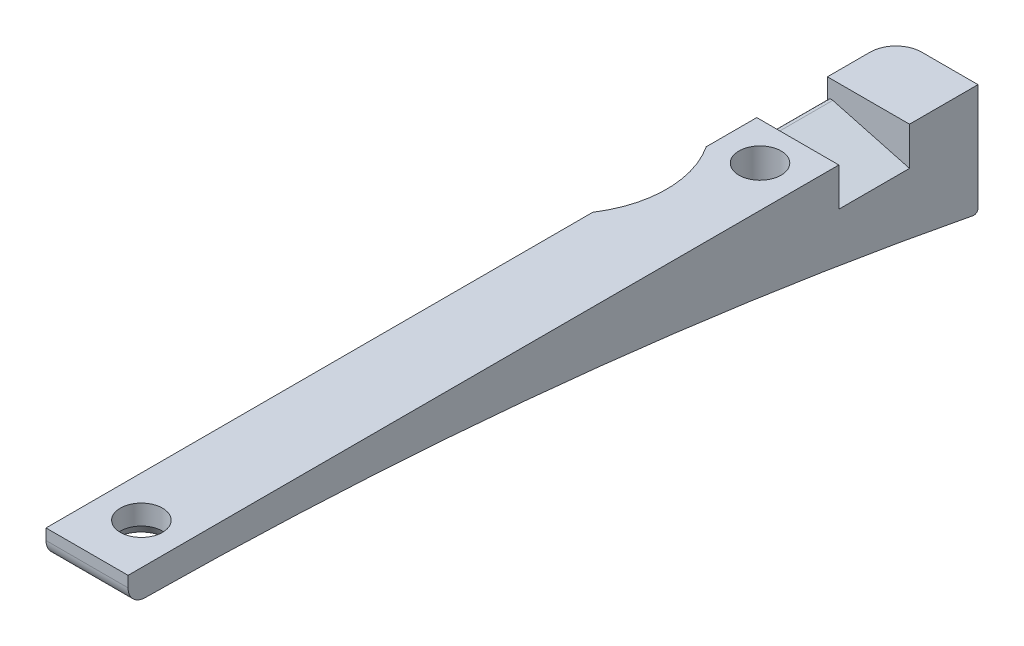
SolidWorks part; units mm, degrees
ref_plane "Спереди" through (0, 0, 0) normal (0, 0, 1) x (1, 0, 0)
ref_plane "Сверху" through (0, 0, 0) normal (0, 1, 0) x (1, 0, 0)
ref_plane "Справа" through (0, 0, 0) normal (1, 0, 0) x (0, 0, -1)
sketch "Эскиз1" plane through (0, 0, 0) normal (1, 0, 0) x (0, 0, -1)
  line L0 (-79.4258, -1.0165) -> (-79.4258, 0)
  line L1 (-79.4258, 0) -> (0, 0)
  line L2 (0, 0) -> (0, -10.0033)
  arc A0 (-0.453, -10.3774) -> (-77.8544, -2.6039) centre (-82.2548, -435.6516) ccw
  arc A1 (-79.4258, -1.0165) -> (-77.8544, -2.6039) centre (-77.8383, -1.0165) ccw
  arc A2 (0, -10.0033) -> (-0.453, -10.3774) centre (-0.381, -10.0033) cw
  point P8 (-79.4258, -2.5908)
  point P11 (0, -10.4648)
  dimension "D4" = 433.07
  dimension "D5" = 1.5875
  dimension "D6" = 0.381
  dimension "D1" = 2.5908
  dimension "D2" = 10.4648
  dimension "D3" = 79.4258
extrude "Бобышка-Вытянуть1" add sketch "Эскиз1" along normal mid plane 7.6708
sketch "Эскиз2" plane through (0, 0, 0) normal (0, 0, -1) x (-1, 0, 0)
  line L0 (-3.8354, -3.5794) -> (3.8354, -1.524)
  line L1 (-3.8354, -10.0033) -> (-3.8354, 0) construction
  line L2 (3.8354, -10.0033) -> (3.8354, 0) construction
  line L3 (3.8354, -1.524) -> (3.8354, 0)
  line L4 (3.8354, 0) -> (-3.8354, 0)
  line L5 (-3.8354, 0) -> (-3.8354, -3.5794)
  dimension "D1" = 1.524
  dimension "D2" = 15
extrude "Вырез-Вытянуть1" cut sketch "Эскиз2" against normal blind 6.604 from offset 6.4008
fillet "Скругление1" radius 0.3969 1 edges at (-3.8354, -1.524, 9.7028)
sketch "Эскиз3" plane through (0, 0, 0) normal (1, 0, 0) x (0, 0, -1)
  line L0 (-16.5354, 3.3928) -> (-16.5354, -7.5971) construction
  line L1 (-14.5669, 0) -> (-16.5354, 0)
  line L2 (-16.5354, 0) -> (-16.5354, -8.0153)
  line L3 (-16.5354, -8.0153) -> (-13.8672, -8.0153)
  line L4 (-13.8672, -8.0153) -> (-14.5669, -6.8034)
  line L5 (-14.5669, -6.8034) -> (-14.5669, 0)
  arc A0 (-0.453, -10.3774) -> (-77.8544, -2.6039) centre (-82.2548, -435.6516) ccw construction
  dimension "D1" = 3.937
  dimension "D2" = 30
  dimension "D3" = 0.7937
  dimension "D4" = 16.5354
revolve "Вырез-Повернуть1" cut sketch "Эскиз3" angle 360 about L0
sketch "Эскиз4" plane through (0, 0, 0) normal (1, 0, 0) x (0, 0, -1)
  line L0 (-74.3458, 7.5093) -> (-74.3458, -2.6538) construction
  line L1 (-74.3458, 0) -> (-72.3773, 0)
  line L2 (-72.3773, 0) -> (-72.3773, -1.86)
  line L3 (-72.3773, -1.86) -> (-71.8891, -2.7056)
  line L4 (-71.8891, -2.7056) -> (-74.3458, -2.7056)
  line L5 (-74.3458, -2.7056) -> (-74.3458, 0)
  line L6 (-13.0048, 0) -> (-79.4258, 0) construction
  arc A0 (-0.453, -10.3774) -> (-77.8544, -2.6039) centre (-82.2548, -435.6516) ccw construction
  dimension "D1" = 74.3458
  dimension "D2" = 3.937
  dimension "D3" = 30
  dimension "D4" = 0.7937
revolve "Вырез-Повернуть2" cut sketch "Эскиз4" angle 360 about L0
sketch "Эскиз5" plane through (0, 0, 0) normal (0, 1, 0) x (1, 0, 0)
  line L0 (-3.8354, -2.413) -> (-3.8354, 0)
  line L2 (-3.8354, 0) -> (-3.8354, -6.4008) construction
  line L4 (-3.8354, 0) -> (-1.4224, 0)
  line L5 (3.8354, 0) -> (-3.8354, 0) construction
  arc A0 (-3.8354, -2.413) -> (-1.4224, 0) centre (-1.4224, -2.413) cw
  dimension "D1" = 2.413
extrude "Вырез-Вытянуть2" cut sketch "Эскиз5" against normal through all
ref_plane "Плоскость1" through (0, 0, 23.0188) normal (0, 0, -1) x (-1, 0, 0)
sketch "Эскиз6" plane through (0, 0, 23.0188) normal (0, 0, -1) x (-1, 0, 0)
  line L0 (2.2479, 0) -> (5.8079, -13.2863) construction
  line L1 (3.8354, 0) -> (3.8354, -10.0051) construction
  line L2 (3.8354, 0) -> (-3.8354, 0) construction
  line L3 (2.2479, 0) -> (11.8164, 2.5639)
  line L4 (11.8164, 2.5639) -> (13.4039, -3.3608)
  line L5 (13.4039, -3.3608) -> (3.8354, -5.9246)
  line L6 (3.8354, -5.9246) -> (2.2479, 0)
  line L7 (11.8164, 2.5639) -> (14.3291, -6.8137) construction
  dimension "D1" = 15
  dimension "D2" = 1.5875
  dimension "D3" = 9.906
revolve "Вырез-Повернуть3" cut sketch "Эскиз6" angle 360 about L7
